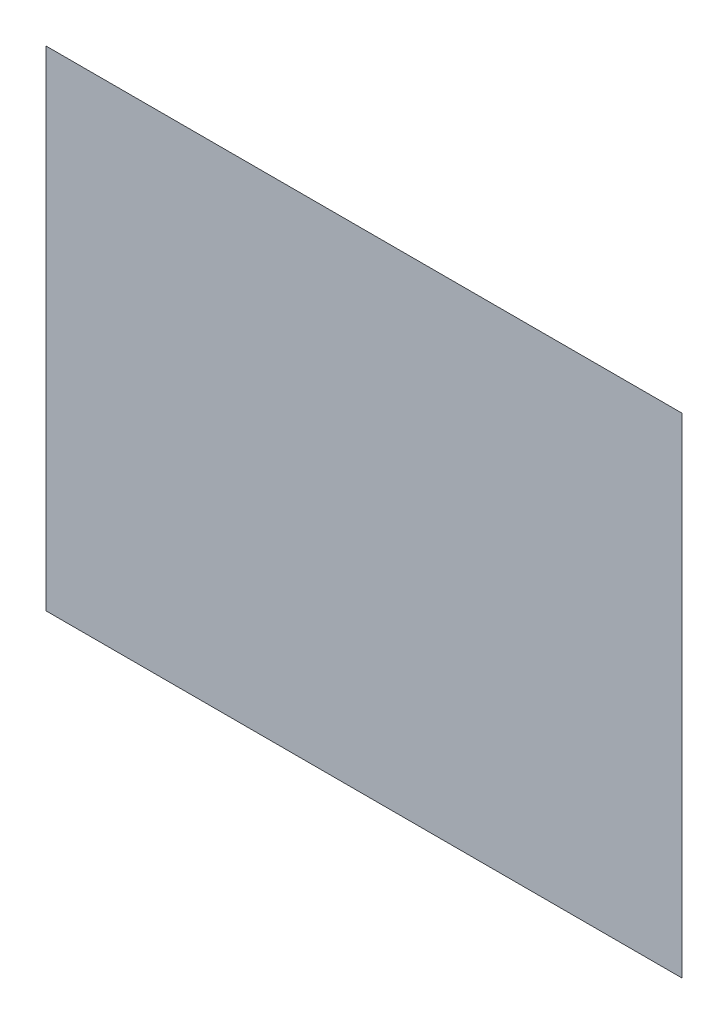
SolidWorks part; units mm, degrees
ref_plane "Front" through (0, 0, 0) normal (0, 0, 1) x (1, 0, 0)
ref_plane "Top" through (0, 0, 0) normal (0, 1, 0) x (1, 0, 0)
ref_plane "Right" through (0, 0, 0) normal (1, 0, 0) x (0, 0, -1)
sketch "Sketch1" plane through (0, 0, 0) normal (0, 0, 1) x (1, 0, 0)
  line L1 (-2480, 2040) -> (2680, 2040)
  line L2 (-2480, 2040) -> (-2480, -1930)
  line L3 (-2480, -1930) -> (2680, -1930)
  line L4 (2680, 2040) -> (2680, -1930)
surface "Surface-Plane1" sketch "Sketch1"
